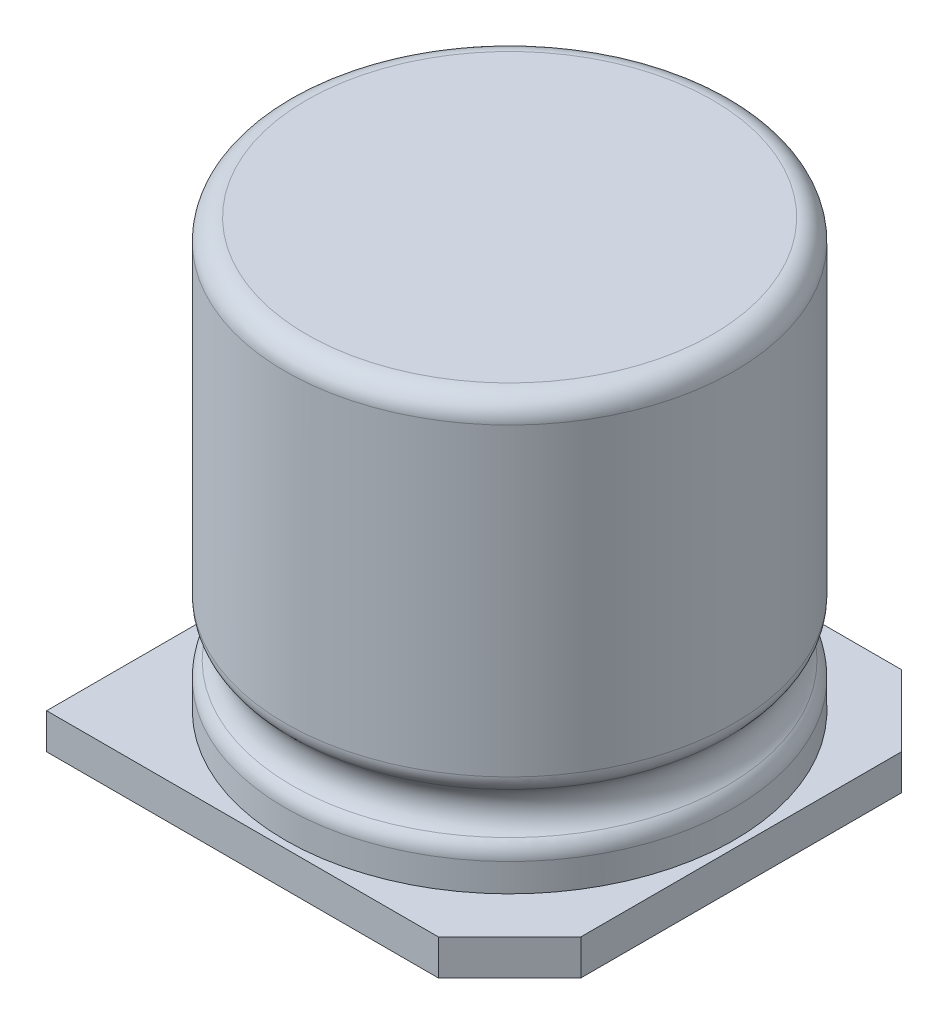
SolidWorks part; units mm, degrees
ref_plane "Front Plane" through (0, 0, 0) normal (0, 0, 1) x (1, 0, 0)
ref_plane "Top Plane" through (0, 0, 0) normal (0, 1, 0) x (1, 0, 0)
ref_plane "Right Plane" through (0, 0, 0) normal (1, 0, 0) x (0, 0, -1)
imported_body "Imported1"
scale "Scale1" scale about centroid uniform scaling yes scale factor 0.75
